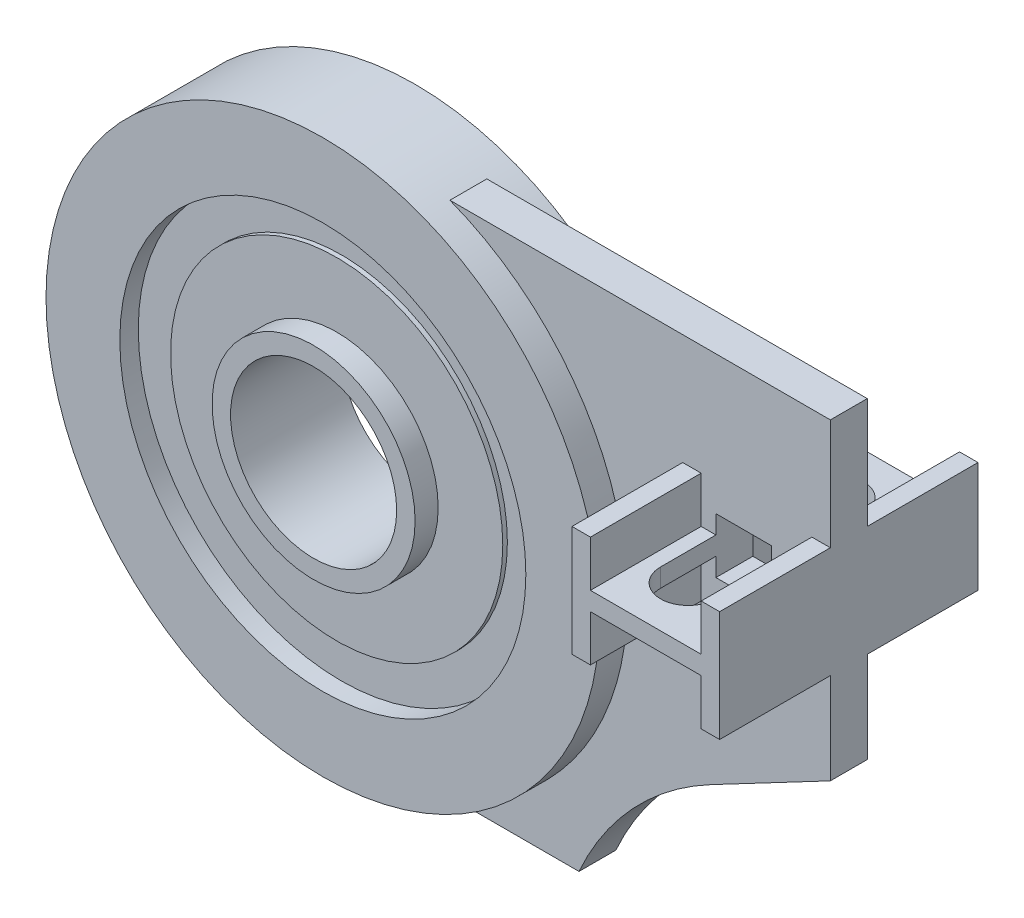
SolidWorks part; units mm, degrees
ref_plane "Face" through (0, 0, 0) normal (0, 0, 1) x (1, 0, 0)
ref_plane "Dessus" through (0, 0, 0) normal (0, 1, 0) x (1, 0, 0)
ref_plane "Droite" through (0, 0, 0) normal (1, 0, 0) x (0, 0, -1)
sketch "Esquisse1" plane through (0, 0, 0) normal (0, 0, 1) x (1, 0, 0)
  circle A0 centre (0, 0) radius 15
  circle A1 centre (0, 0) radius 11
  dimension "D1" = 30
  dimension "D2" = 22
extrude "Exterieur palier" add sketch "Esquisse1" along normal mid plane 5
sketch "Esquisse2" plane through (0, 0, 0) normal (0, 0, 1) x (1, 0, 0)
  circle A0 centre (0, 0) radius 11 construction
  circle A1 centre (0, 0) radius 11
  circle A2 centre (0, 0) radius 9
  dimension "D1" = 18
extrude "Silicone" add sketch "Esquisse2" along normal mid plane 3
sketch "Esquisse3" plane through (0, 0, 0) normal (0, 0, 1) x (1, 0, 0)
  circle A0 centre (0, 0) radius 9 construction
  circle A1 centre (0, 0) radius 9
  circle A2 centre (0, 0) radius 5.5
  dimension "D1" = 11
extrude "Flasque palier" add sketch "Esquisse3" along normal mid plane 3.5
sketch "Esquisse4" plane through (0, 0, 0) normal (0, 0, 1) x (1, 0, 0)
  circle A0 centre (0, 0) radius 5.5 construction
  circle A1 centre (0, 0) radius 5.5
  circle A2 centre (0, 0) radius 4.5
  dimension "D1" = 9
extrude "Portée palier" add sketch "Esquisse4" along normal mid plane 6
sketch "Esquisse5" plane through (0, 0, 0) normal (0, 0, 1) x (1, 0, 0)
  line L0 (5.3852, 14) -> (26, 14)
  line L1 (26, 14) -> (26, -2.94)
  line L2 (5.3852, -14) -> (12.3798, -14)
  line L3 (26, -2.94) -> (25.7673, -3.0627)
  line L4 (79, 25) -> (25.7673, -3.0627) construction
  line L5 (21.3342, -5.3997) -> (25.7673, -3.0627) construction
  line L6 (21.3342, -5.3997) -> (25.7673, -3.0627)
  line L7 (21.3342, -5.3997) -> (19.5386, -6.3463) construction
  line L8 (21.3342, -5.3997) -> (19.5386, -6.3463)
  circle A0 centre (0, 0) radius 15 construction
  arc A1 (5.3852, -14) -> (5.3852, 14) centre (0, 0) ccw
  arc A2 (19.5386, -6.3463) -> (14.779, -10.173) centre (27, -20.5) ccw construction
  arc A3 (19.5386, -6.3463) -> (14.779, -10.173) centre (27, -20.5) ccw
  arc A4 (14.779, -10.173) -> (11.1255, -18.5) centre (27, -20.5) ccw construction
  arc A5 (14.779, -10.173) -> (12.3798, -14) centre (27, -20.5) ccw
  dimension "D4" = 14
  dimension "D1" = 26
  dimension "D2" = 14
extrude "Plaque" add sketch "Esquisse5" along normal mid plane 2
sketch "Esquisse6" plane through (0, 0, -1) normal (0, 0, -1) x (-1, 0, 0)
  line L0 (-26, -2.94) -> (-26, 14) construction
  line L2 (-26, 8) -> (-25, 8)
  line L3 (-26, 8) -> (-26, 2)
  line L4 (-26, 14) -> (-5.3852, 14) construction
  line L5 (-26, 2) -> (-25, 2)
  line L6 (-25, 8) -> (-25, 5.5)
  line L7 (-25, 5.5) -> (-19, 5.5)
  line L8 (-19, 5.5) -> (-19, 4.5) construction
  line L9 (-25, 4.5) -> (-19, 4.5)
  line L10 (-25, 4.5) -> (-25, 2)
  line L11 (-19, 8) -> (-18, 8)
  line L12 (-19, 8) -> (-19, 5.5)
  line L13 (-19, 2) -> (-18, 2)
  line L14 (-18, 8) -> (-18, 2)
  line L15 (-19, 4.5) -> (-19, 2)
  point P16 (0, 0)
  dimension "D1" = 8
  dimension "D2" = 1
  dimension "D3" = 6
  dimension "D5" = 6
extrude "H" add sketch "Esquisse6" along normal blind 6
sketch "Esquisse7" plane through (0, 5.5, 0) normal (0, 1, 0) x (-1, 0, 0)
  line L0 (-22.8, 1) -> (-22.8, -4)
  line L1 (-26, 1) -> (-5.3852, 1) construction
  line L2 (-19.8, -4) -> (-19.8, 1)
  line L3 (-19.8, 1) -> (-22.8, 1)
  line L4 (-21.3, -4) -> (-21.3, -1) construction
  line L5 (-26, -1) -> (-5.3852, -1) construction
  line L7 (-25, -7) -> (-25, -1) construction
  arc A0 (-22.8, -4) -> (-19.8, -4) centre (-21.3, -4) ccw
  dimension "D1" = 3
  dimension "D2" = 3
  dimension "D3" = 2.2
extrude "Passage vis" cut sketch "Esquisse7" along normal blind 1 and the other way blind 2
mirror "Symétrie1" about plane through (0, 0, 0) normal (0, 0, 1) of "H", "Passage vis"
